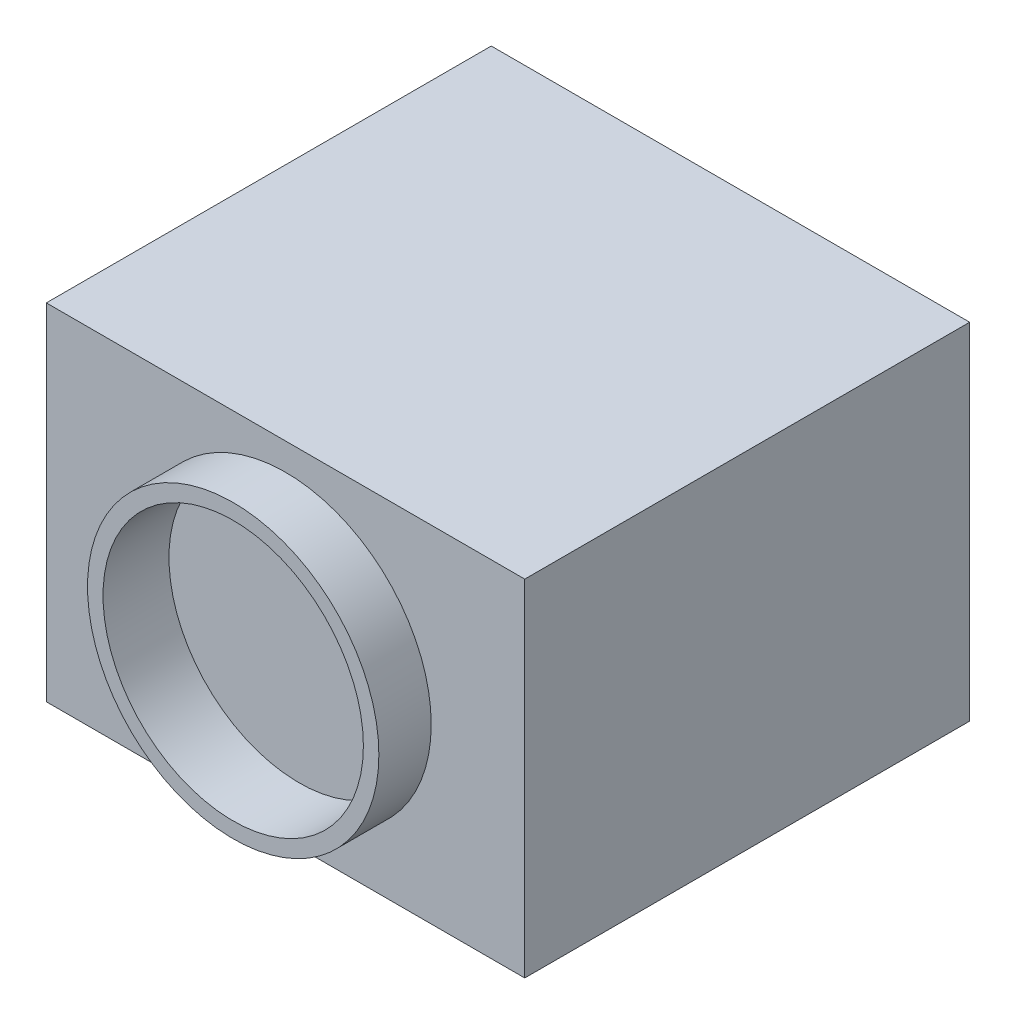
SolidWorks part; units mm, degrees
ref_plane "Front Plane" through (0, 0, 0) normal (0, 0, 1) x (1, 0, 0)
ref_plane "Top Plane" through (0, 0, 0) normal (0, 1, 0) x (1, 0, 0)
ref_plane "Right Plane" through (0, 0, 0) normal (1, 0, 0) x (0, 0, -1)
sketch "Sketch1" plane through (0, 0, 0) normal (0, 0, 1) x (1, 0, 0)
  line L1 (-22.85, 16.5) -> (22.85, 16.5)
  line L2 (-22.85, 16.5) -> (-22.85, -16.5)
  line L3 (-22.85, -16.5) -> (22.85, -16.5)
  line L4 (22.85, 16.5) -> (22.85, -16.5)
  dimension "D1" = 45.7
  dimension "D2" = 22.85
  dimension "D3" = 33
  dimension "D4" = 16.5
extrude "Extrude1" add sketch "Sketch1" along normal blind 42.5
sketch "Sketch2" plane through (0, 0, 42.5) normal (0, 0, 1) x (1, 0, 0)
  circle A0 centre (0, 0) radius 13.9151
extrude "Extrude2" add sketch "Sketch2" along normal blind 5
sketch "Sketch3" plane through (0, 0, 0) normal (0, 0, -1) x (-1, 0, 0)
  line L1 (-7.663, -5.4448) -> (5.5792, -5.4448)
  line L2 (-7.663, -5.4448) -> (-7.663, -15.6621)
  line L3 (-7.663, -15.6621) -> (5.5792, -15.6621)
  line L4 (5.5792, -5.4448) -> (5.5792, -15.6621)
  line L5 (-6.5203, -6.5203) -> (4.4365, -6.5203)
  line L6 (-6.5203, -6.5203) -> (-6.5203, -14.5866)
  line L7 (-6.5203, -14.5866) -> (4.4365, -14.5866)
  line L8 (4.4365, -6.5203) -> (4.4365, -14.5866)
  circle A0 centre (13.5111, 0) radius 5.7801
  circle A1 centre (13.5111, 0) radius 5.0414
extrude "Extrude3" add sketch "Sketch3" along normal blind 6.3
sketch "Sketch5" plane through (0, 0, 47.5) normal (0, 0, 1) x (1, 0, 0)
  circle A0 centre (0, 0) radius 12.4356
extrude "Extrude4" cut sketch "Sketch5" against normal blind 6.3
sketch "Sketch6" plane through (0, -16.5, 0) normal (0, -1, 0) x (1, 0, 0)
  line L1 (-16.25, 42.5) -> (16.25, 42.5)
  line L2 (-16.25, 42.5) -> (-16.25, 18.5)
  line L3 (-16.25, 18.5) -> (16.25, 18.5)
  line L4 (16.25, 42.5) -> (16.25, 18.5)
  line L5 (-22.85, 0) -> (22.85, 0) construction
  dimension "D1" = 24
  dimension "D2" = 32.5
  dimension "D3" = 16.25
  dimension "D5" = 18.5
extrude "Extrude5" [suppressed] add sketch "Sketch6" along normal blind 2.15
sketch "Sketch7" [suppressed] plane through (0, -18.65, 0) normal (0, -1, 0) x (1, 0, 0)
  line L0 (16.25, 42.5) -> (-16.25, 42.5) construction
  line L1 (-9.6, 42.5) -> (9.6, 42.5)
  line L2 (-9.6, 42.5) -> (-9.6, 18.5)
  line L3 (-9.6, 18.5) -> (9.6, 18.5)
  line L4 (9.6, 42.5) -> (9.6, 18.5)
  line L5 (-16.25, 18.5) -> (16.25, 18.5) construction
  dimension "D1" = 19.2
  dimension "D2" = 9.6
extrude "Extrude6" [suppressed] add sketch "Sketch7" along normal blind 3.88
sketch "Sketch9" [suppressed] plane through (0, -22.53, 0) normal (0, -1, 0) x (1, 0, 0)
  line L0 (9.6, 42.5) -> (-9.6, 42.5) construction
  point P0 (0, 37.8)
  point P1 (0, 23.3)
  dimension "D1" = 4.7
  dimension "D2" = 14.5
hole_wizard "1/4-20 Tapped Hole2" positions "3DSketch2" profile "Sketch10" tap size "1/4-20" standard "Ansi Inch"
sketch3d "3DSketch2" [suppressed]
  point P0 (0, -22.53, 37.8)
  point P3 (0, -22.53, 23.3)
sketch "Sketch10" plane through (0, -22.53, 37.8) normal (1, 0, 0) x (0, 0, -1)
  line L0 (0, 0) -> (0, 20.5838)
  line L1 (0, 20.5838) -> (2.5527, 19.05)
  line L2 (2.5527, 19.05) -> (2.5527, 0)
  line L5 (2.5527, 0) -> (0, 0)
  line L10 (0, 20.5838) -> (-2.5527, 19.05) construction
  line L11 (0, -6.35) -> (0, 107.95) construction
  dimension "Tap Drill Dia." = 5.1054
  dimension "Tap Drill Depth" = 19.05
  dimension "Drill Angle" = 118
